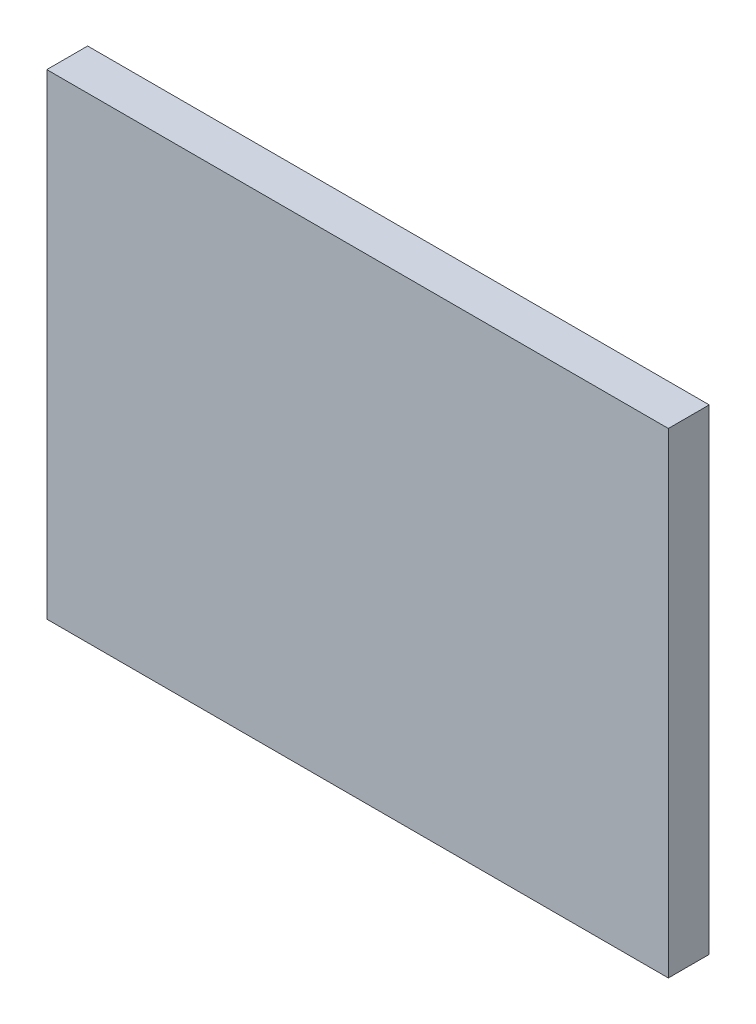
SolidWorks part; units mm, degrees
ref_plane "Front" through (0, 0, 0) normal (0, 0, 1) x (1, 0, 0)
ref_plane "Top" through (0, 0, 0) normal (0, 1, 0) x (1, 0, 0)
ref_plane "Right" through (0, 0, 0) normal (1, 0, 0) x (0, 0, -1)
sketch "Sketch1" plane through (0, 0, 0) normal (0, 0, 1) x (1, 0, 0)
  line L1 (-11.2173, 33.2678) -> (64.8453, 33.2678)
  line L2 (-11.2173, 33.2678) -> (-11.2173, -24.9701)
  line L3 (-11.2173, -24.9701) -> (64.8453, -24.9701)
  line L4 (64.8453, 33.2678) -> (64.8453, -24.9701)
extrude "Extrude1" add sketch "Sketch1" along normal blind 5
